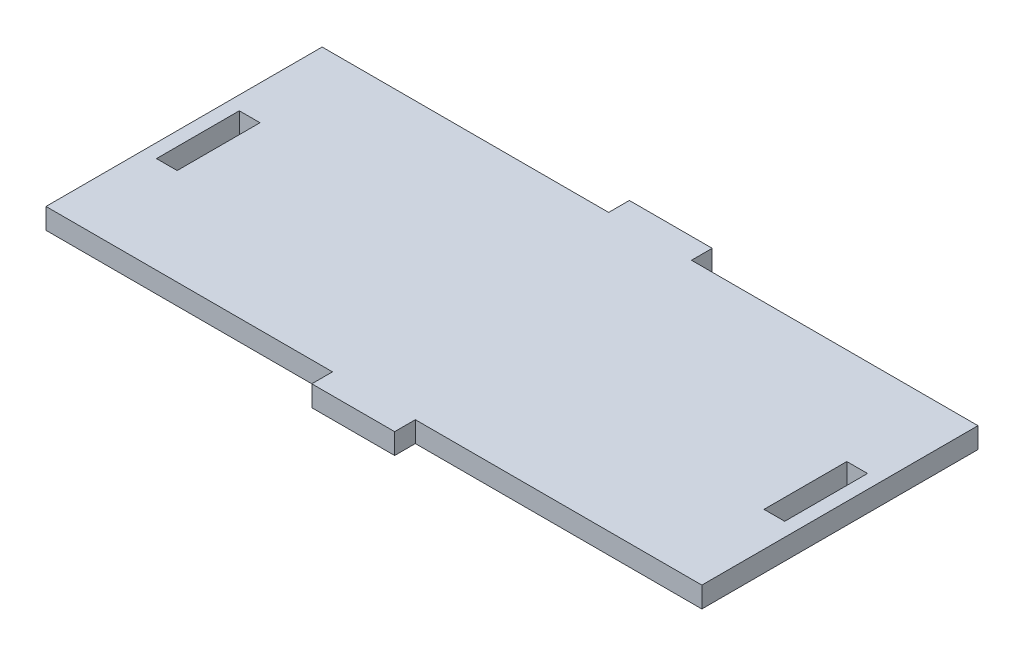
SolidWorks part; units mm, degrees
ref_plane "Front Plane" through (0, 0, 0) normal (0, 0, 1) x (1, 0, 0)
ref_plane "Top Plane" through (0, 0, 0) normal (0, 1, 0) x (1, 0, 0)
ref_plane "Right Plane" through (0, 0, 0) normal (1, 0, 0) x (0, 0, -1)
sketch "Sketch1" plane through (0, 0, 0) normal (0, 1, 0) x (1, 0, 0)
  line L0 (45.5, 0) -> (45.5, -40) construction
  line L1 (0, 0) -> (91, 0)
  line L2 (0, 0) -> (0, -40)
  line L3 (0, -40) -> (91, -40)
  line L4 (91, 0) -> (91, -40)
  line L5 (0, -20) -> (91, -20) construction
  line L6 (39.5, 0) -> (51.5, 0)
  line L7 (39.5, 0) -> (39.5, 3)
  line L8 (39.5, 3) -> (51.5, 3)
  line L9 (51.5, 0) -> (51.5, 3)
  line L10 (51.5, -40) -> (51.5, -43)
  line L11 (0, -14) -> (3, -14)
  line L12 (0, -14) -> (0, -26)
  line L13 (0, -26) -> (3, -26)
  line L14 (3, -14) -> (3, -26)
  line L15 (39.5, -43) -> (51.5, -43)
  line L16 (39.5, -40) -> (39.5, -43)
  line L17 (39.5, -40) -> (51.5, -40)
  line L18 (88, -14) -> (88, -26)
  line L19 (91, -26) -> (88, -26)
  line L20 (91, -14) -> (91, -26)
  line L21 (91, -14) -> (88, -14)
  line L22 (91, -40) -> (93, -40)
  line L23 (0, 0) -> (-2, 0)
  line L24 (0, 0) -> (0, -40)
  line L25 (0, -40) -> (-2, -40)
  line L26 (-2, 0) -> (-2, -40)
  line L27 (91, 0) -> (91, -40)
  line L28 (91, 0) -> (93, 0)
  line L29 (93, 0) -> (93, -40)
  dimension "D1" = 40
  dimension "D2" = 91
  dimension "D3" = 3
  dimension "D4" = 12
  dimension "D5" = 6
  dimension "D6" = 3
  dimension "D7" = 12
  dimension "D8" = 6
  dimension "D9" = 2
extrude "Boss-Extrude1" add sketch "Sketch1" along normal blind 3 contours L21 L4 L1 L2 L11 L14 L13 L3 L19 L18 | L3 L16 L15 L10 | L23 L26 L25 L2 | L1 L9 L8 L7 | L29 L28 L4 L22
